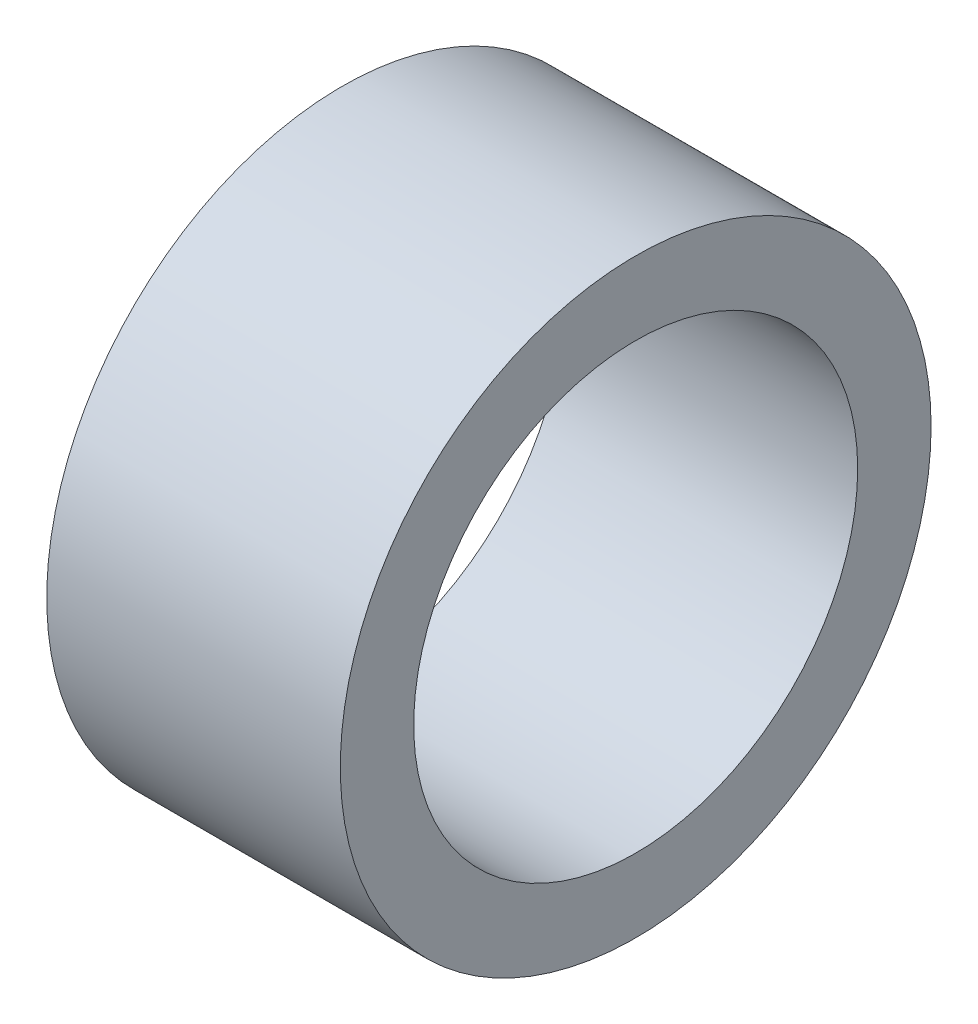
SolidWorks part; units mm, degrees
ref_plane "Front Plane" through (0, 0, 0) normal (0, 0, 1) x (1, 0, 0)
ref_plane "Top Plane" through (0, 0, 0) normal (0, 1, 0) x (1, 0, 0)
ref_plane "Right Plane" through (0, 0, 0) normal (1, 0, 0) x (0, 0, -1)
sketch "Sketch1" plane through (0, 0, 0) normal (1, 0, 0) x (0, 0, -1)
  circle A0 centre (0, 0) radius 3.025
  circle A1 centre (0, 0) radius 4.025
  dimension "D1" = 6.05
  dimension "D2" = 8.05
extrude "Boss-Extrude1" add sketch "Sketch1" along normal blind 4
